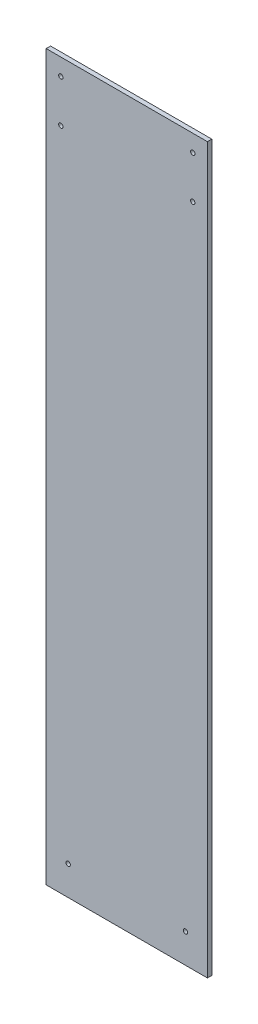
SolidWorks part; units mm, degrees
ref_plane "Front Plane" through (0, 0, 0) normal (0, 0, 1) x (1, 0, 0)
ref_plane "Top Plane" through (0, 0, 0) normal (0, 1, 0) x (1, 0, 0)
ref_plane "Right Plane" through (0, 0, 0) normal (1, 0, 0) x (0, 0, -1)
sketch "Sketch1" plane through (0, 0, 0) normal (0, 0, 1) x (1, 0, 0)
  line L0 (-55, 240) -> (55, 240)
  line L1 (-55, 240) -> (-55, -254)
  line L2 (-55, -254) -> (55, -254)
  line L3 (55, 240) -> (55, -254)
  line L4 (-1055, -234) -> (48945, -234) construction
  circle A0 centre (45, 228.5) radius 1.5
  circle A1 centre (45, 199.5) radius 1.5
  circle A2 centre (-45, 199.5) radius 1.5
  circle A3 centre (-45, 228.5) radius 1.5
  circle A4 centre (40, -234) radius 1.5
  circle A5 centre (-40, -234) radius 1.5
  dimension "D3" = 3
  dimension "D1" = 494
  dimension "D2" = 20
  dimension "D4" = 15
  dimension "D5" = 15
extrude "Boss-Extrude1" add sketch "Sketch1" along normal blind 3
sketch "Sketch2" plane through (0, 0, 3) normal (0, 0, 1) x (1, 0, 0)
  line L0 (-55, 240) -> (-55, -254) construction
  line L1 (-55, -224) -> (55, -224)
  line L2 (-55, -224) -> (-55, -494)
  line L3 (-55, -494) -> (55, -494)
  line L4 (55, -224) -> (55, -494)
  line L5 (55, -254) -> (55, 240) construction
  line L6 (-55, -254) -> (55, -254) construction
  circle A0 centre (40, -234) radius 1.5 construction
  circle A1 centre (-40, -234) radius 1.5 construction
  circle A2 centre (40, -234) radius 1.5
  circle A3 centre (-40, -234) radius 1.5
  point P6 (0, 0)
  dimension "D1" = 30
  dimension "D2" = 270
